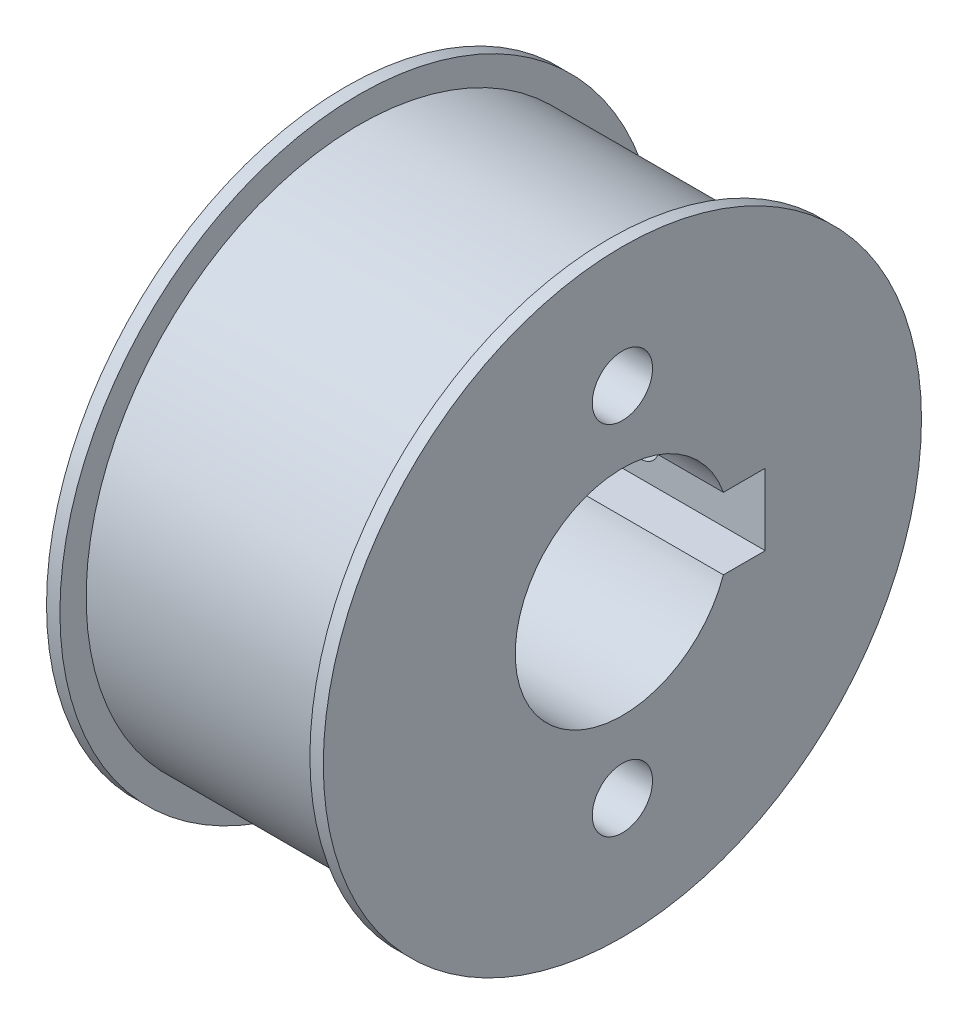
SolidWorks part; units mm, degrees
ref_plane "Plan1" through (0, 0, 0) normal (0, 0, 1) x (1, 0, 0)
ref_plane "Plan2" through (0, 0, 0) normal (0, 1, 0) x (1, 0, 0)
ref_plane "Plan3" through (0, 0, 0) normal (1, 0, 0) x (0, 0, -1)
sketch "Esquisse1" plane through (0, 0, 0) normal (0, 0, 1) x (1, 0, 0)
  line L0 (80.8467, 0) -> (-92.4293, 0) construction
  line L1 (-31, 33.5) -> (-31, 12)
  line L2 (-31, 33.5) -> (-29.5, 33.5)
  line L3 (-29.5, 33.5) -> (-29.5, 30.56)
  line L4 (-29.5, 30.56) -> (-1.5, 30.56)
  line L5 (-1.5, 30.56) -> (-1.5, 33.5)
  line L6 (-1.5, 33.5) -> (0, 33.5)
  line L7 (0, 33.5) -> (0, 12)
  line L8 (0, 12) -> (-31, 12)
  dimension "D1" = 33.5
  dimension "D2" = 1.5
  dimension "D3" = 31
  dimension "D4" = 12
  dimension "D5" = 30.56
revolve "Base-Révolution" add sketch "Esquisse1" angle 360 about L0
other "Perçage1"
sketch "Esquisse4" plane through (0, 0, 0) normal (1, 0, 0) x (0, 0, -1)
  circle A0 centre (0, 20) radius 3.375
  dimension "D1" = 6.75
  dimension "D2" = 20
pattern_circular "Répétition circulaire1" count 2 every 180 about axis through (80.8467, 0, 0) along (-1, 0, 0)
sketch "Esquisse5" plane through (0, 0, 0) normal (0, 0, 1) x (1, 0, 0)
  line L0 (80.8467, 0) -> (-92.4293, 0) construction
  circle A0 centre (-14, 0) radius 2.1
  dimension "D1" = 4.2
  dimension "D2" = 14
extrude "Enlèv. mat.-Extru.2" cut sketch "Esquisse5" against normal blind 35
sketch "Esquisse6" plane through (0, 0, 0) normal (1, 0, 0) x (0, 0, -1)
  line L0 (0, 0) -> (-40.6371, 0) construction
  line L1 (38.9558, 0) -> (27.0884, 0) construction
  line L2 (16, 4) -> (7.5127, 4)
  line L3 (16, 4) -> (16, -4)
  line L4 (7.5127, -4) -> (16, -4)
  line L5 (7.5127, -4) -> (7.5127, 4)
  dimension "D1" = 8
  dimension "D2" = 4
  dimension "D3" = 16
extrude "Enlèv. mat.-Extru.5" cut sketch "Esquisse6" against normal through all
